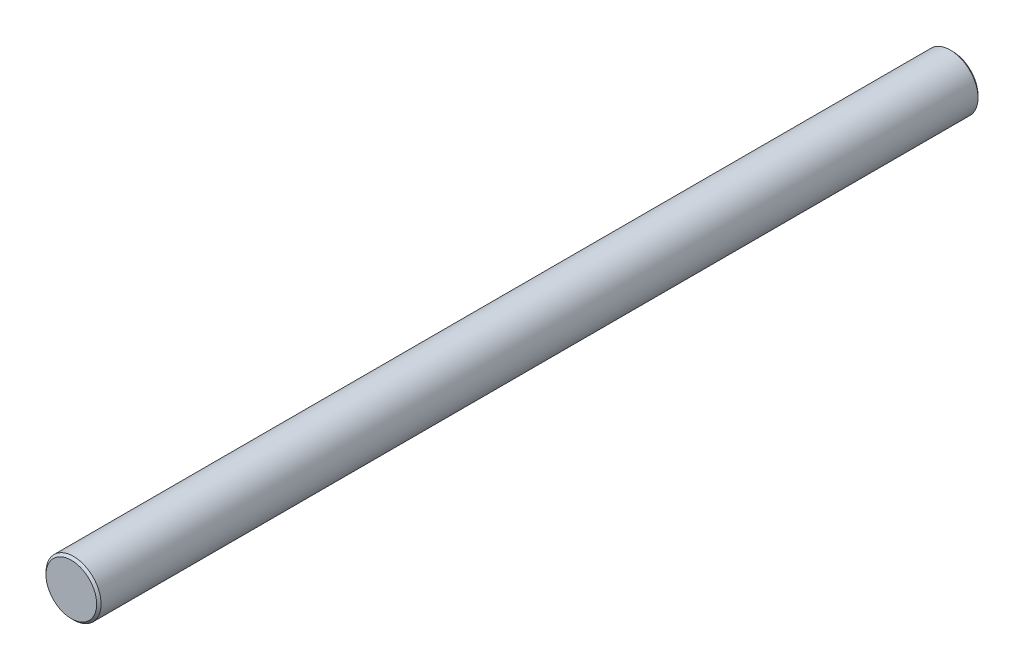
SolidWorks part; units mm, degrees
ref_plane "Front/Back" through (0, 0, 0) normal (0, 0, 1) x (1, 0, 0)
ref_plane "Top/Bottom" through (0, 0, 0) normal (0, 1, 0) x (1, 0, 0)
ref_plane "Right/Left" through (0, 0, 0) normal (1, 0, 0) x (0, 0, -1)
sketch "Sketch2" plane through (0, 0, 0) normal (0, 0, 1) x (1, 0, 0)
  circle A0 centre (0, 0) radius 9.525
  dimension "D1" = 19.05
extrude "Extrude2" add sketch "Sketch2" along normal blind 304.8
chamfer "Chamfer1" distance 0.762 angle 45 2 edges at (9.525, 0, 0) (9.525, 0, 304.8)
